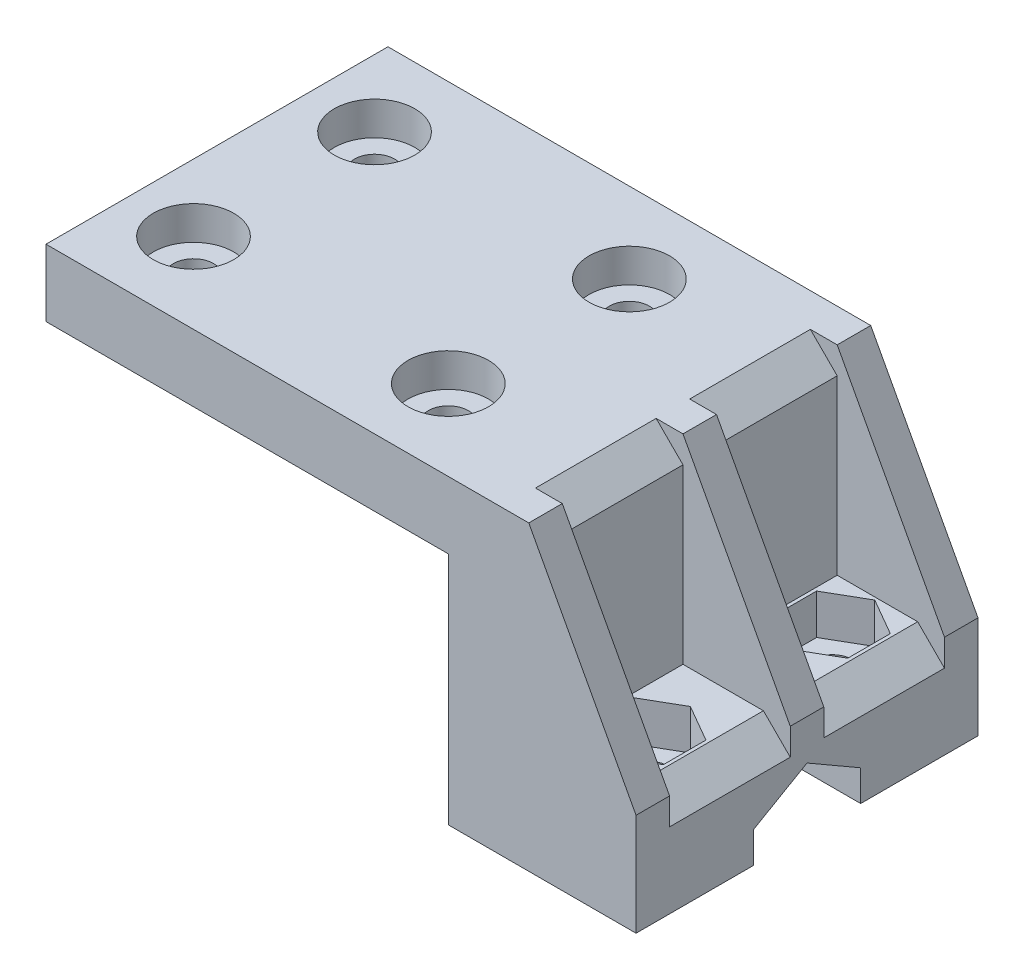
SolidWorks part; units mm, degrees
ref_plane "Front Plane" through (0, 0, 0) normal (0, 0, 1) x (1, 0, 0)
ref_plane "Top Plane" through (0, 0, 0) normal (0, 1, 0) x (1, 0, 0)
ref_plane "Right Plane" through (0, 0, 0) normal (1, 0, 0) x (0, 0, -1)
sketch "Sketch2" plane through (0, 0, 2.2136) normal (0, 0, 1) x (1, 0, 0)
  line L0 (-5, 10) -> (-5, 5)
  line L1 (-5, 5) -> (25, 5)
  line L2 (25, 5) -> (25, -12.5)
  line L4 (25, -12.5) -> (39, -12.5)
  line L6 (39, -12.5) -> (39, -4.8812)
  line L7 (39, -4.8812) -> (31, -4.8812)
  line L8 (31, -4.8812) -> (31, 10)
  line L9 (31, 10) -> (-5, 10)
  dimension "D2" = 6
extrude "Boss-Extrude1" add sketch "Sketch2" along normal up to surface (25.5 mm away)
sketch "Sketch3" plane through (0, -12.5, 0) normal (0, -1, 0) x (1, 0, 0)
  circle A0 centre (34, 8.0886) radius 1.5
  circle A1 centre (34, 21.8386) radius 1.5
  dimension "D1" = 3
  dimension "D2" = 3
extrude "Cut-Extrude1" cut sketch "Sketch3" against normal through all
sketch "Sketch4" plane through (0, -4.8812, 0) normal (0, 1, 0) x (1, 0, 0)
  line L0 (31, -27.7136) -> (31, -2.2136) construction
  line L1 (31.25, -6.5009) -> (31.25, -9.6763)
  line L2 (31.25, -9.6763) -> (34, -11.264)
  line L3 (34, -11.264) -> (36.75, -9.6763)
  line L4 (36.75, -9.6763) -> (36.75, -6.5009)
  line L5 (36.75, -6.5009) -> (34, -4.9132)
  line L6 (34, -4.9132) -> (31.25, -6.5009)
  line L7 (31.25, -20.2509) -> (31.25, -23.4263)
  line L8 (31.25, -23.4263) -> (34, -25.014)
  line L9 (34, -25.014) -> (36.75, -23.4263)
  line L10 (36.75, -23.4263) -> (36.75, -20.2509)
  line L11 (36.75, -20.2509) -> (34, -18.6632)
  line L12 (34, -18.6632) -> (31.25, -20.2509)
  circle A0 centre (34, -8.0886) radius 2.75 construction
  circle A1 centre (34, -21.8386) radius 2.75 construction
  dimension "D1" = 5.5
  dimension "D2" = 5.5
extrude "Cut-Extrude2" cut sketch "Sketch4" against normal blind 3
sketch "Sketch5" plane through (0, 10, 0) normal (0, 1, 0) x (1, 0, 0)
  line L0 (-5, -27.7136) -> (31, -27.7136) construction
  line L1 (31, -2.2136) -> (-5, -2.2136) construction
  line L2 (-5, -27.7136) -> (-5, -2.2136) construction
  line L3 (25, -2.2136) -> (25, 63.7983) construction
  circle A0 centre (19, -8.2136) radius 1.5
  circle A1 centre (19, -21.7136) radius 1.5
  circle A2 centre (0, -21.7136) radius 1.5
  circle A3 centre (0, -8.2136) radius 1.5
  dimension "D5" = 3
  dimension "D1" = 6
  dimension "D2" = 6
  dimension "D3" = 5
  dimension "D4" = 6
extrude "Cut-Extrude3" cut sketch "Sketch5" against normal through all
sketch "Sketch6" plane through (0, 10, 0) normal (0, 1, 0) x (1, 0, 0)
  circle A0 centre (0, -8.2136) radius 3
  circle A1 centre (0, -21.7136) radius 3
  circle A2 centre (19, -21.7136) radius 3
  circle A3 centre (19, -8.2136) radius 3
  dimension "D1" = 6
extrude "Cut-Extrude4" cut sketch "Sketch6" against normal blind 2.5
sketch "Sketch7" plane through (0, 0, 27.7136) normal (0, 0, 1) x (1, 0, 0)
  line L0 (39, -4.8812) -> (31, 10)
  line L1 (31, 10) -> (31, -4.8812)
  line L2 (31, -4.8812) -> (39, -4.8812)
extrude "Boss-Extrude2" add sketch "Sketch7" against normal blind 2.5
ref_plane "Plane1" through (0, 0, 14.9636) normal (0, 0, -1) x (-1, 0, 0)
mirror "Mirror1" about plane through (0, 0, 14.9636) normal (0, 0, -1) of "Boss-Extrude2"
sketch "Sketch8" plane through (0, 0, 14.9636) normal (0, 0, -1) x (-1, 0, 0)
  line L0 (-31, 10) -> (-31, -4.8812)
  line L1 (-31, -4.8812) -> (-39, -4.8812)
  line L2 (-39, -4.8812) -> (-31, 10)
extrude "Boss-Extrude3" add sketch "Sketch8" along normal mid plane 2.5
chamfer "Chamfer1" distance 2 angle 45 4 edges at (39, -4.8812, 9.2136) (39, -4.8812, 20.7136) (31, 10, 20.7136) (31, 10, 9.2136)
sketch "Sketch10" plane through (25, 0, 0) normal (-1, 0, 0) x (0, 0, 1)
  line L0 (27.7136, -12.5) -> (2.2136, -12.5) construction
  circle A0 centre (14.9636, -12.5) radius 7.5
  dimension "D1" = 15
extrude "Cut-Extrude5" cut sketch "Sketch10" against normal up to surface (4 mm away)
sketch "Sketch11" plane through (39, 0, 0) normal (1, 0, 0) x (0, 0, -1)
  line L0 (-27.7136, -12.5) -> (-2.2136, -12.5) construction
  line L1 (-14.9636, -7.8812) -> (-18.9636, -10.1906)
  line L2 (-18.9636, -10.1906) -> (-18.9636, -14.8094)
  line L3 (-18.9636, -14.8094) -> (-14.9636, -17.1188)
  line L4 (-14.9636, -17.1188) -> (-10.9636, -14.8094)
  line L5 (-10.9636, -14.8094) -> (-10.9636, -10.1906)
  line L6 (-10.9636, -10.1906) -> (-14.9636, -7.8812)
  line L7 (-27.7136, -4.8812) -> (-27.7136, -12.5) construction
  circle A0 centre (-14.9636, -12.5) radius 4 construction
  dimension "D1" = 8
extrude "Cut-Extrude6" cut sketch "Sketch11" against normal up to surface (10 mm away)
